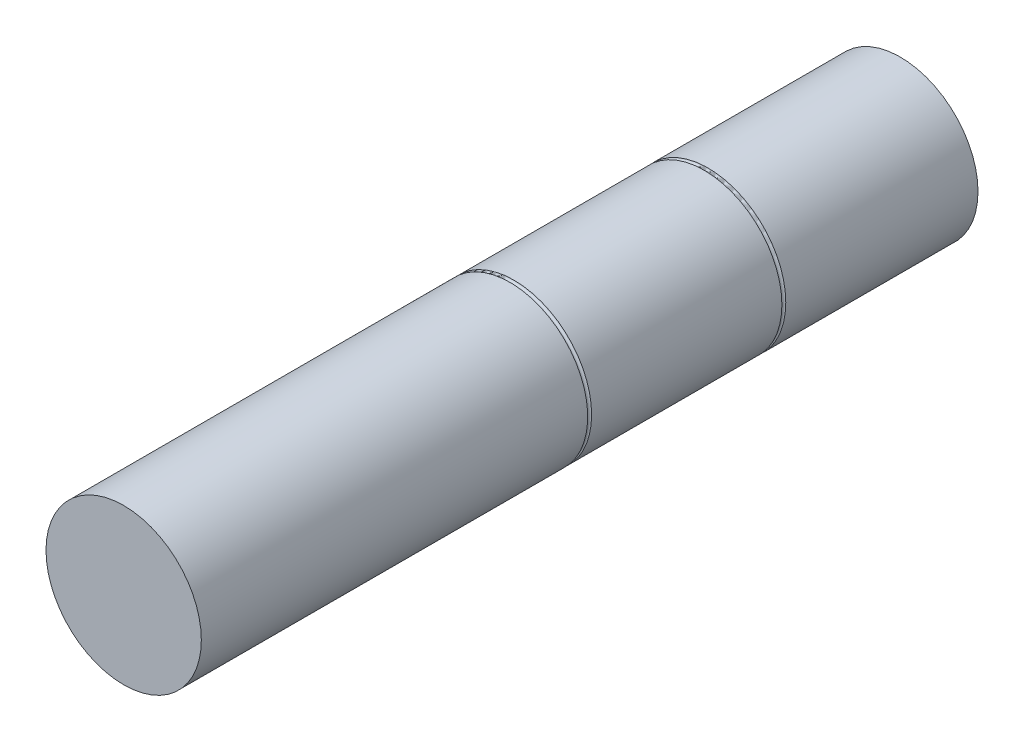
SolidWorks part; units mm, degrees
ref_plane "Ebene vorne" through (0, 0, 0) normal (0, 0, 1) x (1, 0, 0)
ref_plane "Ebene oben" through (0, 0, 0) normal (0, 1, 0) x (1, 0, 0)
ref_plane "Ebene rechts" through (0, 0, 0) normal (1, 0, 0) x (0, 0, -1)
sketch "Skizze1" plane through (0, 0, 0) normal (0, 0, 1) x (1, 0, 0)
  circle A0 centre (0, 0) radius 10
  dimension "D1" = 20
extrude "Linear austragen1" add sketch "Skizze1" along normal blind 100
sketch "Skizze2" plane through (0, 0, 0) normal (0, 1, 0) x (1, 0, 0)
  line L0 (10, -100) -> (10, 0) construction
  line L1 (10, 0) -> (-10, 0) construction
  circle A0 centre (10, -25) radius 0.25
  circle A1 centre (10, -50) radius 0.25
  dimension "D1" = 0.5
  dimension "D2" = 25
  dimension "D3" = 50
revolve "Schnitt-Rotation1" cut sketch "Skizze2" angle 360 about axis through (0, 0, 100) along (0, 0, -1)
equation "\"LÄNGE\"=0"
equation "\"BREITE\"=0"
equation "\"HÖHE\"=0"
equation "\"DURCHMESSER\"=0"
equation "\"Stückzahl\"= 1"
